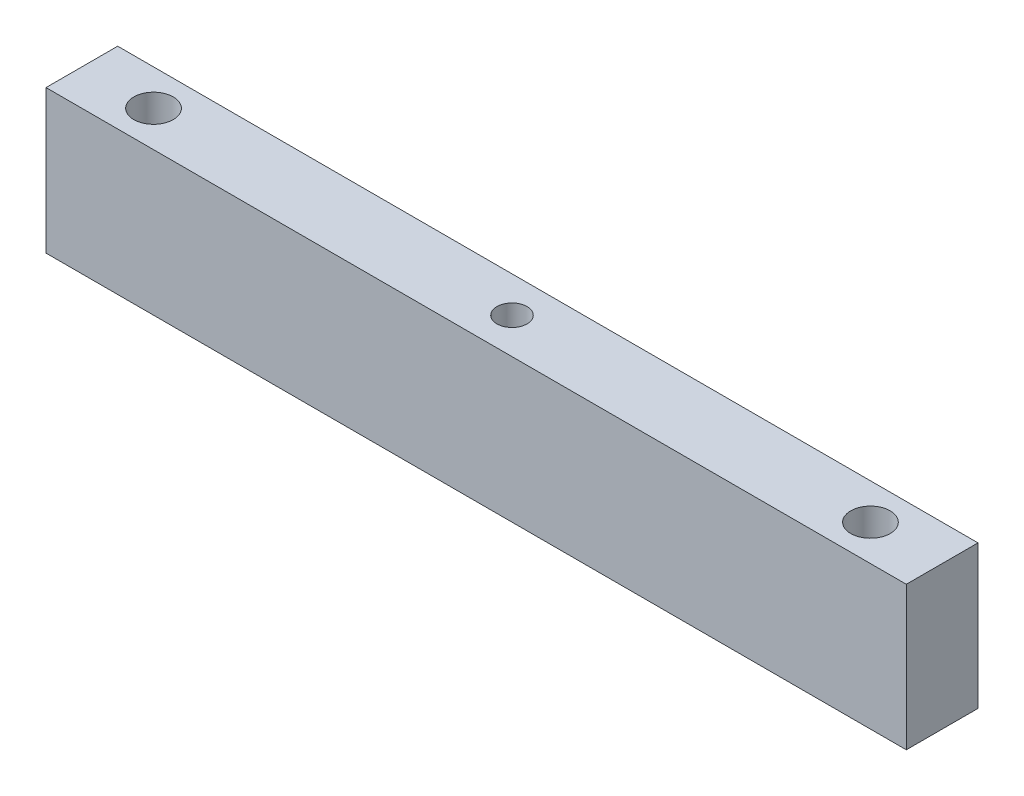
SolidWorks part; units mm, degrees
ref_plane "Спереди" through (0, 0, 0) normal (0, 0, 1) x (1, 0, 0)
ref_plane "Сверху" through (0, 0, 0) normal (0, 1, 0) x (1, 0, 0)
ref_plane "Справа" through (0, 0, 0) normal (1, 0, 0) x (0, 0, -1)
sketch "Эскиз1" plane through (0, 0, 0) normal (0, 0, 1) x (1, 0, 0)
  line L1 (60, 10) -> (-60, 10)
  line L2 (60, 10) -> (60, -10)
  line L3 (60, -10) -> (-60, -10)
  line L4 (-60, 10) -> (-60, -10)
  line L5 (60, 10) -> (-60, -10) construction
  line L6 (60, -10) -> (-60, 10) construction
  point P0 (0, 0)
  dimension "D1" = 120
  dimension "D2" = 20
extrude "Бобышка-Вытянуть1" add sketch "Эскиз1" along normal blind 10
hole_wizard "Отверстие с зазором M51" positions "Эскиз2" profile "Эскиз3" hole size "M5" standard "ISO"
sketch "Эскиз2" plane through (0, 10, 0) normal (0, 1, 0) x (1, 0, 0)
  line L0 (-60, -10) -> (-60, 0) construction
  line L1 (60, -10) -> (60, 0) construction
  line L2 (60, 0) -> (-60, 0) construction
  point P0 (-50, -5)
  point P2 (50, -5)
  dimension "D1" = 10
  dimension "D2" = 10
  dimension "D3" = 5
sketch "Эскиз3" plane through (-50, 10, 5) normal (1, 0, 0) x (0, 0, 1)
  line L0 (0, 0) -> (0, 21.6524)
  line L1 (0, 21.6524) -> (2.75, 20)
  line L2 (2.75, 20) -> (2.75, 0)
  line L5 (2.75, 0) -> (0, 0)
  line L10 (0, 21.6524) -> (-2.75, 20) construction
  line L11 (0, -6.35) -> (0, 107.95) construction
  dimension "Диаметр отверстия" = 5.5
  dimension "Глубина отверстия" = 20
  dimension "Угол заточки сверла" = 118
hole_wizard "Отверстие обработанное метчиком M51" positions "Эскиз4" profile "Эскиз5" tap size "M5" standard "ISO"
sketch "Эскиз4" plane through (0, 10, 0) normal (0, 1, 0) x (1, 0, 0)
  line L0 (-60, -10) -> (-60, 0) construction
  line L1 (60, 0) -> (-60, 0) construction
  point P0 (0, -5)
  dimension "D1" = 60
  dimension "D2" = 5
sketch "Эскиз5" plane through (0, 10, 5) normal (1, 0, 0) x (0, 0, 1)
  line L0 (0, 0) -> (0, 21.2618)
  line L1 (0, 21.2618) -> (2.1, 20)
  line L2 (2.1, 20) -> (2.1, 0)
  line L5 (2.1, 0) -> (0, 0)
  line L10 (0, 21.2618) -> (-2.1, 20) construction
  line L11 (0, -6.35) -> (0, 107.95) construction
  dimension "Диаметр сверла" = 4.2
  dimension "Глубина сверла" = 20
  dimension "Угол заточки сверла" = 118
